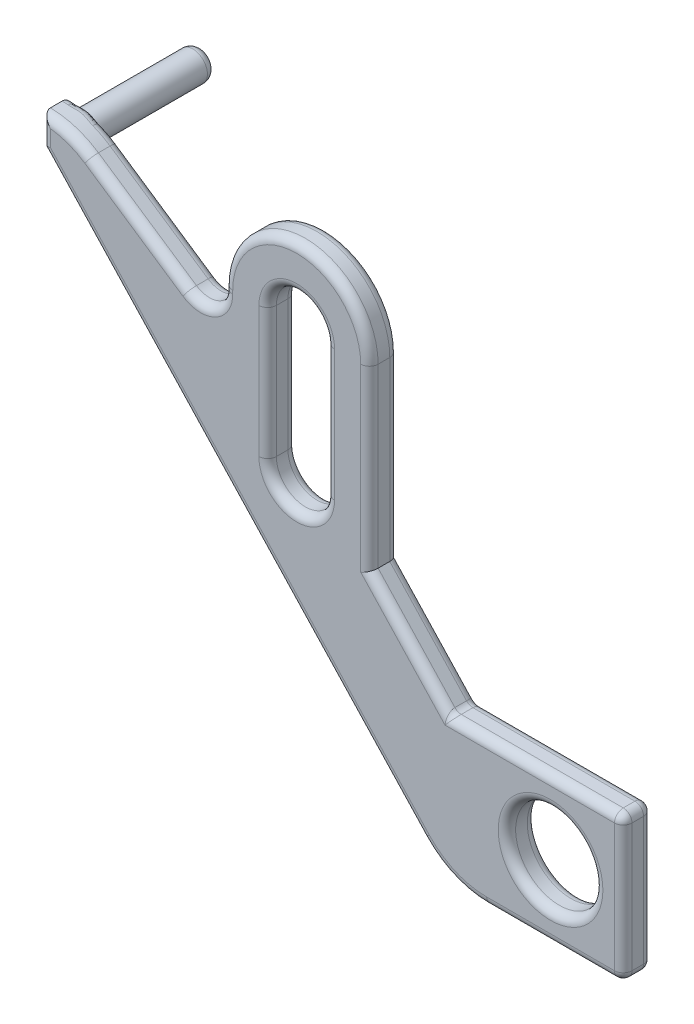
SolidWorks part; units mm, degrees
ref_plane "Plan1" through (0, 0, 0) normal (0, 0, 1) x (1, 0, 0)
ref_plane "Plan2" through (0, 0, 0) normal (0, 1, 0) x (1, 0, 0)
ref_plane "Plan3" through (0, 0, 0) normal (1, 0, 0) x (0, 0, -1)
sketch "Esquisse1" plane through (0, 0, 0) normal (0, 0, 1) x (1, 0, 0)
  line L0 (2.5, 2.5) -> (2.5, -2.5)
  line L1 (2.5, -2.5) -> (-3.5, -2.5)
  line L2 (-3.5, -2.5) -> (-17.5, 12.5)
  line L3 (-17.5, 12.5) -> (-17.5, 13.5)
  line L4 (-3.5, 2.5) -> (-8.9585, 8.3484) construction
  line L5 (-8.9585, 8.3484) -> (-16.6075, 13.5) construction
  line L6 (-3.5, 2.5) -> (-6.2293, 5.4242)
  line L7 (2.5, 2.5) -> (-3.5, 2.5)
  line L8 (-6.2293, 5.4242) -> (-6.2293, 11.5)
  line L9 (-11.2293, 9.8778) -> (-11.2293, 11.5)
  line L10 (-11.2293, 9.8778) -> (-16.6075, 13.5)
  line L11 (-16.6075, 13.5) -> (-17.5, 13.5)
  line L12 (-9.7293, 11.5) -> (-9.7293, 7)
  line L13 (-7.7293, 11.5) -> (-7.7293, 7)
  circle A0 centre (0, 0) radius 1.5
  arc A1 (-6.2293, 11.5) -> (-11.2293, 11.5) centre (-8.7293, 11.5) ccw
  arc A2 (-7.7293, 11.5) -> (-9.7293, 11.5) centre (-8.7293, 11.5) ccw
  arc A3 (-9.7293, 7) -> (-7.7293, 7) centre (-8.7293, 7) ccw
  dimension "D1" = 3
  dimension "D9" = 2.5
  dimension "D14" = 1
  dimension "D2" = 5
  dimension "D3" = 2.5
  dimension "D4" = 2.5
  dimension "D5" = 6
  dimension "D6" = 6
  dimension "D7" = 14
  dimension "D8" = 15
  dimension "D10" = 1
  dimension "D11" = 9
  dimension "D12" = 4
  dimension "D13" = 6.4842
  dimension "D15" = 4.5
extrude "Base-Extrusion" add sketch "Esquisse1" along normal blind 1
fillet "Congé1" radius 0.8 1 edges at (-11.2293, 9.8778, 0.5)
fillet "Congé2" radius 3 4 edges at (-17.0537, 13.5, 0) (-3.5, -2.5, 0.5) (-16.6075, 13.5, 0.5) (-17.0537, 13.5, 1)
fillet "Congé3" radius 0.3 18 edges at (-6.2293, 8.4621, 1) (-8.7293, 14, 1) (-11.2293, 11.4406, 1) (-17.5, 13, 1) (1.5, 0, 1) (-10.9448, 5.4765, 1) (2.5, 0, 1) (-8.7293, 12.5, 1) (-9.7293, 9.25, 1) (-8.7293, 6, 1) (-7.7293, 9.25, 1) (-0.5, 2.5, 1) (-14.162, 11.853, 1) (-11.6535, 10.6749, 1) (0.1518, -2.5, 1) (-3.392, -2.2514, 1) (-16.6362, 13.3658, 1) (-4.8646, 3.9621, 1)
sketch "Esquisse2" plane through (0, 0, 0) normal (0, 0, -1) x (-1, 0, 0)
  line L2 (17.5, 13.5) -> (17.5, 12.5) construction
  circle A0 centre (17, 12.8013) radius 0.5
  dimension "D1" = 1
extrude "Boss.-Extru.1" add sketch "Esquisse2" along normal blind 4
fillet "Congé7" radius 0.3 23 edges at (2.4121, -2.4121, 0.9121) (2.4121, 2.4121, 0.9121) (-3.5382, 2.4121, 0.9121) (-11.2293, 11.4406, 0) (-8.7293, 14, 0) (-6.2293, 8.4621, 0) (-4.8646, 3.9621, 0) (-0.5, 2.5, 0) (1.5, 0, 0) (-8.7293, 12.5, 0) (-9.7293, 9.25, 0) (-8.7293, 6, 0) (-7.7293, 9.25, 0) (-14.162, 11.853, 0) (-11.6535, 10.6749, 0) (0.1518, -2.5, 0) (-3.392, -2.2514, 0) (-16.6362, 13.3658, 0) (-3.5, 2.5, 0.35) (2.5, 2.5, 0.35) (2.5, -2.5, 0.35) (2.5, 0, 0) (-10.9448, 5.4765, 0)
fillet "Congé10" radius 0.3 1 edges at (-17.5, 12.8013, -4)
